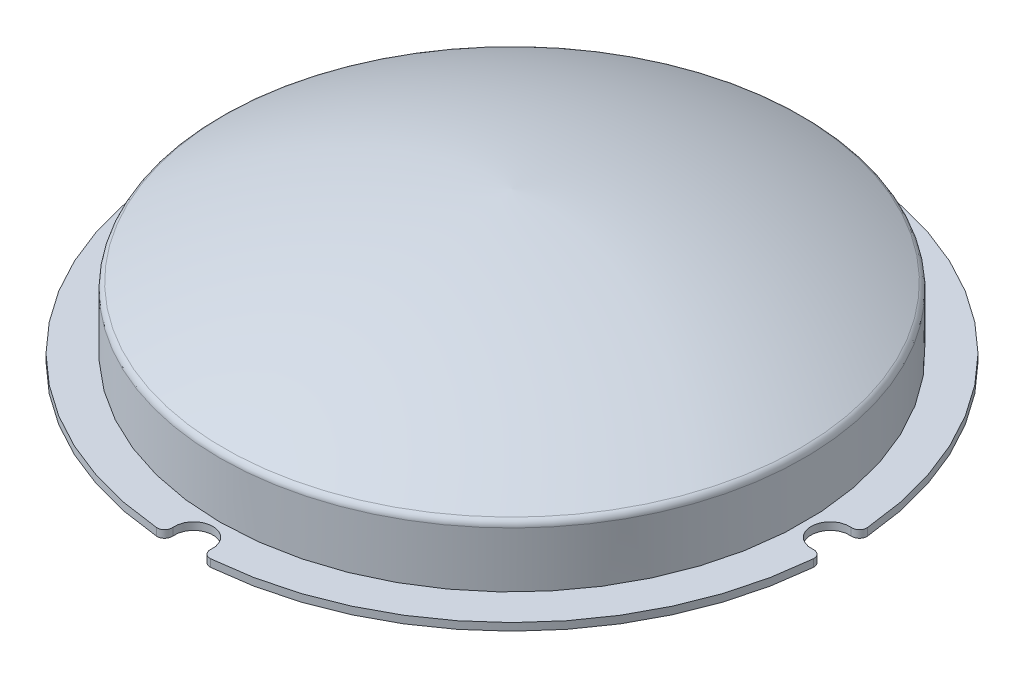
SolidWorks part; units mm, degrees
ref_plane "Front Plane" through (0, 0, 0) normal (0, 0, 1) x (1, 0, 0)
ref_plane "Top Plane" through (0, 0, 0) normal (0, 1, 0) x (1, 0, 0)
ref_plane "Right Plane" through (0, 0, 0) normal (1, 0, 0) x (0, 0, -1)
sketch "Sketch1" plane through (0, 0, 0) normal (0, 0, 1) x (1, 0, 0)
  line L0 (0, 0) -> (0, 20) construction
  line L1 (0, 0) -> (38, 0) construction
  line L2 (38, 0) -> (44, 0)
  line L3 (44, 0) -> (44, 1)
  line L4 (44, 1) -> (39, 1)
  line L5 (39, 1) -> (39, 9)
  line L6 (0, 20) -> (0, 18.9985)
  line L7 (38, 8.4002) -> (38, 0)
  line L10 (38, 1) -> (38, 8.4002) construction
  line L11 (38, 1) -> (38, 1) construction
  line L12 (38, 1) -> (38, 1) construction
  line L13 (38, 1) -> (38, 1) construction
  spline S0 degree 2 poles (0, 20) (20.6313, 18.8754) (39, 9) knots 0 0 0 1 1 1
  spline S1 degree 1 poles (-0.0544, 19.0015) (38, 8.4002) knots 0 0 1 1 construction
  spline S2 degree 3 poles (-0.0544, 19.0015) (1.6138, 18.9105) (4.9567, 18.6395) (11.5192, 17.7488) (19.5602, 15.979) (27.3756, 13.3316) (33.486, 10.692) (36.5131, 9.1879) (38, 8.4002) knots 0 0 0 0 0.123192 0.246384 0.492768 0.739152 0.862344 0.985536 0.985536 0.985536 0.985536 only from (0, 18.9985) to (38, 8.4002)
  point P9 (0, 0)
  dimension "D1" = 20
  dimension "D2" = 38
  dimension "D3" = 44
  dimension "D4" = 1
  dimension "D5" = 1
  dimension "D6" = 8
revolve "Revolve1" add sketch "Sketch1" angle 360 about L0
fillet "Fillet1" radius 1 1 edges at (0, 9, -39)
fillet "Fillet2" radius 1 1 edges at (0, 8.4002, -38)
sketch "Sketch2" plane through (0, 1, 0) normal (0, 1, 0) x (1, 0, 0)
  line L0 (0, 0) -> (0, 44) construction
  circle A0 centre (0, 0) radius 44 construction
  circle A1 centre (0, 42.5) radius 2.55
  circle A2 centre (42.5, 0) radius 2.55
  circle A3 centre (0, -42.5) radius 2.55
  circle A4 centre (-42.5, 0) radius 2.55
  point P17 (0, 0)
  dimension "D1" = 5.1
  dimension "D2" = 42.5
  dimension "D3" = 4
extrude "Cut-Extrude1" cut sketch "Sketch2" against normal through all
fillet "Fillet3" radius 1 8 edges at (-2.0976, 0.5, 43.95) (2.0976, 0.5, 43.95) (-43.95, 0.5, -2.0976) (-43.95, 0.5, 2.0976) (2.0976, 0.5, -43.95) (-2.0976, 0.5, -43.95) (43.95, 0.5, 2.0976) (43.95, 0.5, -2.0976)
